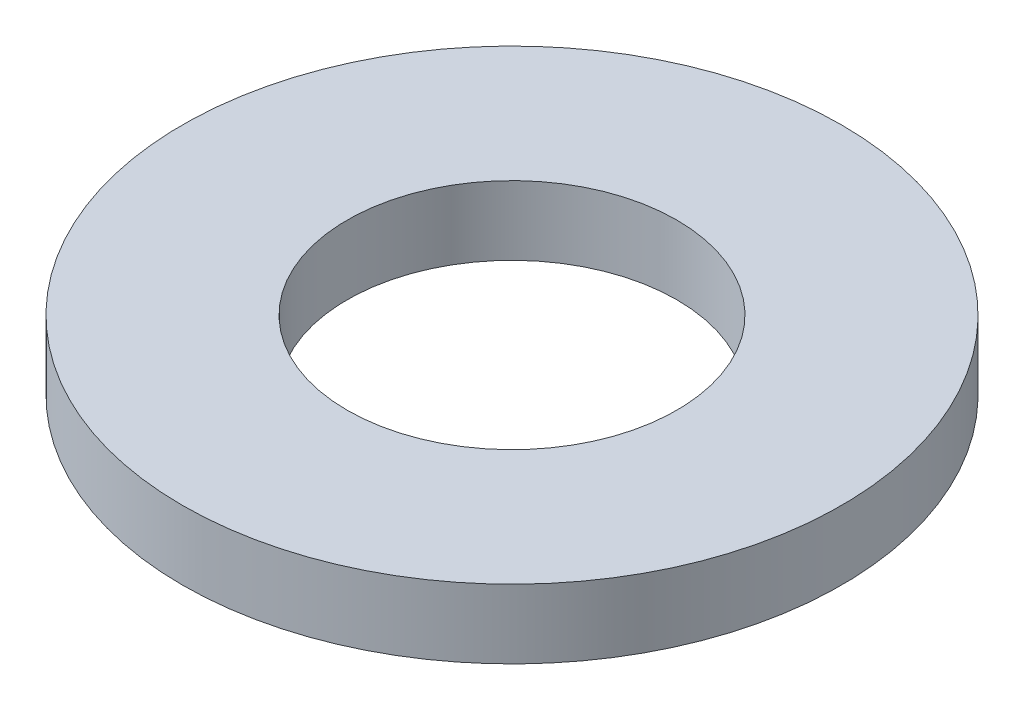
SolidWorks part; units mm, degrees
ref_plane "Front Plane" through (0, 0, 0) normal (0, 0, 1) x (1, 0, 0)
ref_plane "Top Plane" through (0, 0, 0) normal (0, 1, 0) x (1, 0, 0)
ref_plane "Right Plane" through (0, 0, 0) normal (1, 0, 0) x (0, 0, -1)
sketch "Sketch1" plane through (0, 0, 0) normal (0, 1, 0) x (1, 0, 0)
  circle A0 centre (0, 0) radius 10.5
  dimension "OD" = 21
extrude "Boss-Extrude1" add sketch "Sketch1" along normal blind 2.2
sketch "Sketch5" plane through (0, 2.2, 0) normal (0, 1, 0) x (-1, 0, 0)
  circle A0 centre (0, 0) radius 5.25
  dimension "ID" = 10.5
extrude "Cut-Extrude1" cut sketch "Sketch5" against normal through all
